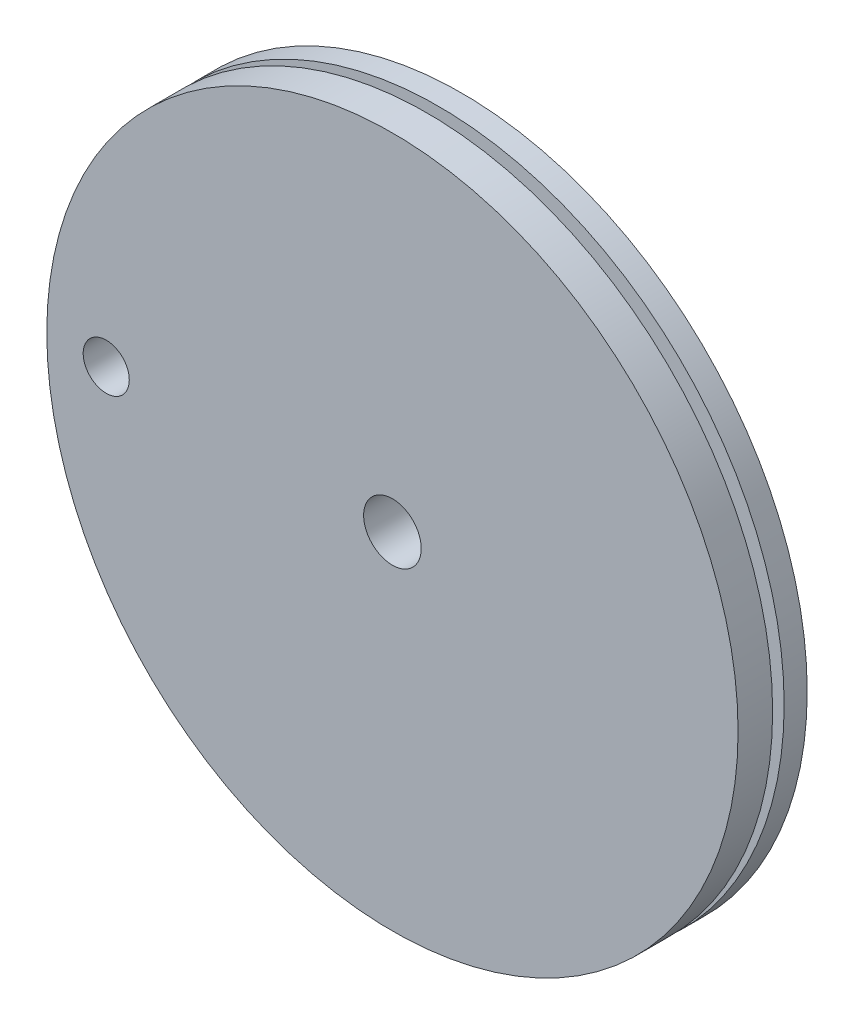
SolidWorks part; units mm, degrees
ref_plane "Plan de face" through (0, 0, 0) normal (0, 0, 1) x (1, 0, 0)
ref_plane "Plan de dessus" through (0, 0, 0) normal (0, 1, 0) x (1, 0, 0)
ref_plane "Plan de droite" through (0, 0, 0) normal (1, 0, 0) x (0, 0, -1)
sketch "Esquisse1" plane through (0, 0, 0) normal (0, 0, 1) x (1, 0, 0)
  circle A0 centre (0, 0) radius 30
  dimension "D1" = 60
extrude "Extrusion2" add sketch "Esquisse1" along normal blind 3
sketch "Esquisse2" plane through (0, 0, 3) normal (0, 0, 1) x (1, 0, 0)
  circle A0 centre (0, 0) radius 28.5
  dimension "D1" = 57
extrude "Enlèv. mat.-Extru.1" cut sketch "Esquisse2" against normal blind 1 flip side to cut
sketch "Esquisse3" plane through (0, 0, 3) normal (0, 0, 1) x (1, 0, 0)
  circle A0 centre (0, 0) radius 30
  dimension "D1" = 60
extrude "Extrusion3" add sketch "Esquisse3" along normal blind 3
sketch "Esquisse4" plane through (0, 0, 6) normal (0, 0, 1) x (1, 0, 0)
  circle A0 centre (0, 0) radius 2.5
  circle A1 centre (-24.8397, 0) radius 2
  dimension "D1" = 5
  dimension "D2" = 4
extrude "Enlèv. mat.-Extru.2" cut sketch "Esquisse4" against normal through all
